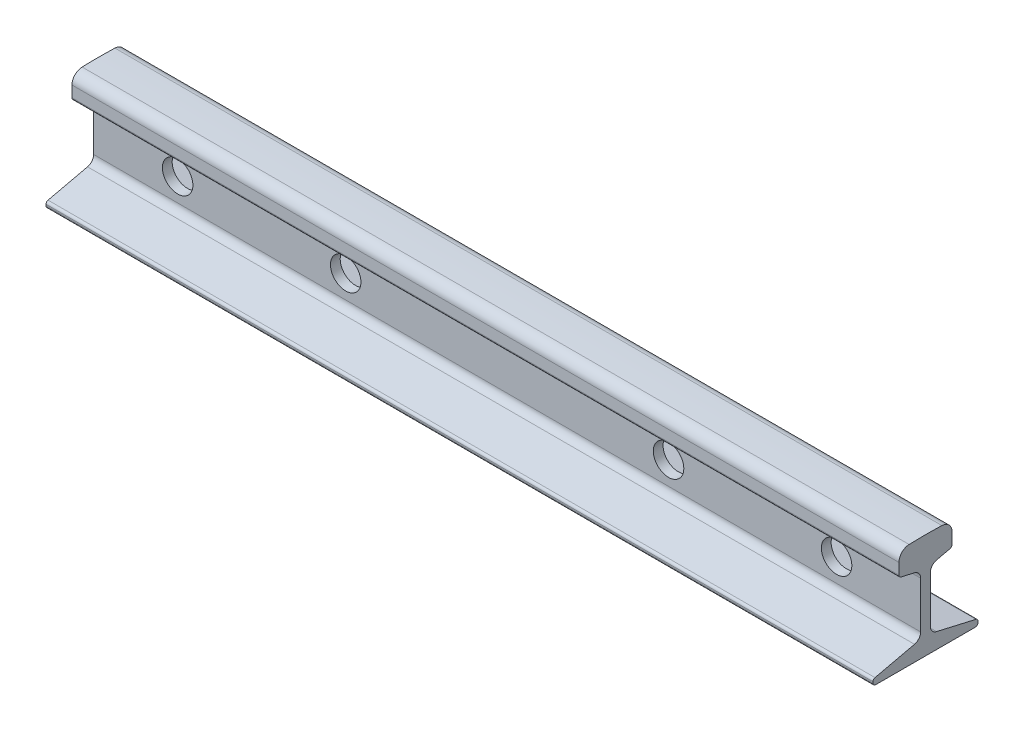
SolidWorks part; units mm, degrees
ref_plane "Front" through (0, 0, 0) normal (0, 0, 1) x (1, 0, 0)
ref_plane "Top" through (0, 0, 0) normal (0, 1, 0) x (1, 0, 0)
ref_plane "Right" through (0, 0, 0) normal (1, 0, 0) x (0, 0, -1)
sketch "Sketch1" plane through (0, 0, 0) normal (1, 0, 0) x (0, 0, -1)
  line L1 (16.05, 63.0771) -> (16.05, 49.0444)
  line L2 (16.05, 49.0444) -> (2.95, 46.02)
  line L3 (2.95, 46.02) -> (2.95, 10.3)
  line L4 (2.95, 10.3) -> (31.75, 3.651)
  line L5 (31.75, 3.651) -> (31.75, 0)
  line L6 (31.75, 0) -> (-31.75, 0)
  line L7 (0, 0) -> (0, 92.0717) construction
  line L8 (-31.75, 3.651) -> (-31.75, 0)
  line L9 (-2.95, 10.3) -> (-31.75, 3.651)
  line L10 (-2.95, 46.02) -> (-2.95, 10.3)
  line L11 (-16.05, 49.0444) -> (-2.95, 46.02)
  line L12 (-16.05, 63.0771) -> (-16.05, 49.0444)
  arc A0 (-16.05, 63.0771) -> (16.05, 63.0771) centre (0, -241.3) cw
  dimension "D5" = 304.8
  dimension "D6" = 63.5
  dimension "D1" = 63.5
  dimension "D2" = 13
  dimension "D3" = 5.9
  dimension "D4" = 10.3
  dimension "D7" = 32.1
  dimension "D8" = 35.72
  dimension "D9" = 13
extrude "Base" add sketch "Sketch1" along normal blind 500
fillet "Fillet1" radius 6.35 2 edges at (250, 63.0771, -16.05) (250, 63.0771, 16.05)
fillet "Fillet2" radius 4.76 4 edges at (250, 46.02, -2.95) (250, 10.3, -2.95) (250, 46.02, 2.95) (250, 10.3, 2.95)
fillet "Fillet3" radius 1.59 6 edges at (250, 49.0444, 16.05) (250, 0, -31.75) (250, 3.651, -31.75) (250, 0, 31.75) (250, 3.651, 31.75) (250, 49.0444, -16.05)
sketch "Sketch2" plane through (416.8909, -3.4733, 2.95) normal (0, 0, 1) x (1, 0, 0)
  line L0 (-416.8909, 45.707) -> (-416.8909, 17.5595) construction
  line L1 (-416.8909, 66.8122) -> (83.1091, 66.8122) construction
  line L3 (83.1091, 45.707) -> (83.1091, 17.5595) construction
  circle A0 centre (-366.0945, 31.4722) radius 9.2173
  circle A1 centre (-264.4945, 31.4722) radius 9.2173
  circle A2 centre (-69.2873, 31.4722) radius 9.2173
  circle A3 centre (32.3127, 31.4722) radius 9.2173
  dimension "D2" = 50.7964
  dimension "D3" = 18.4345
  dimension "D4" = 101.6
  dimension "D5" = 50.7964
  dimension "D6" = 101.6
  dimension "D1" = 35.34
extrude "Cut-Extrude1" cut sketch "Sketch2" against normal through all
equation "\"D5@Sketch2\" = \"D2@Sketch2\""
equation "\"D6@Sketch2\" = \"D4@Sketch2\""
